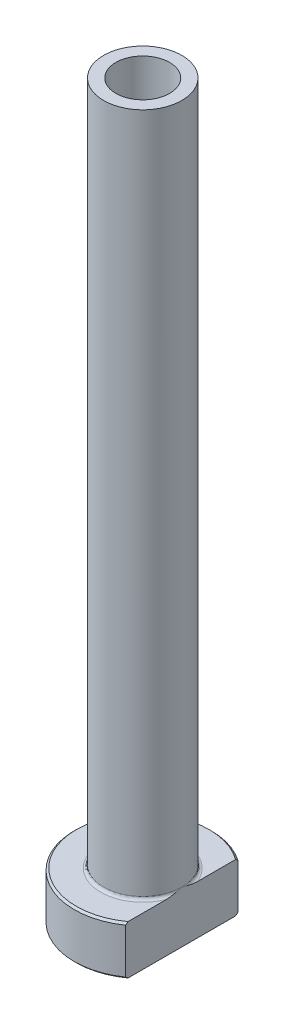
SolidWorks part; units mm, degrees
ref_plane "Front Plane" through (0, 0, 0) normal (0, 0, 1) x (1, 0, 0)
ref_plane "Top Plane" through (0, 0, 0) normal (0, 1, 0) x (1, 0, 0)
ref_plane "Right Plane" through (0, 0, 0) normal (1, 0, 0) x (0, 0, -1)
sketch "Sketch1" plane through (0, 0, 0) normal (0, 0, 1) x (1, 0, 0)
  line L0 (-2.75, 75) -> (-4, 75)
  line L1 (-4, 75) -> (-4, 5)
  line L2 (-4, 5) -> (-7, 5)
  line L3 (-7, 5) -> (-7, 0)
  line L4 (6.05, 0) -> (-6.05, 0) construction
  line L5 (-7, 0) -> (-3, 0)
  line L6 (-2.75, 30) -> (-2.75, 75)
  line L7 (0, 92.1877) -> (0, -15.5353) construction
  line L8 (0, -7.7) -> (0, 7.7) construction
  line L9 (-2.75, 30) -> (-3, 18)
  line L10 (-3, 18) -> (-3, 0)
  dimension "D1" = 0.25
  dimension "ID" = 5.5
  dimension "OD" = 8
  dimension "L" = 75
  dimension "H" = 14
  dimension "T" = 5
  dimension "N" = 45
  dimension "D2" = 12
  dimension "L-N" = 30
revolve "Revolve1" add sketch "Sketch1" angle 360 about L7
fillet "Fillet1" radius 0.3 1 edges at (0, 5, 4)
chamfer "Chamfer1" distance 0.2 angle 45 2 edges at (0, 5, 7) (0, 0, 7)
sketch "Sketch2" plane through (0, 0, 0) normal (0, -1, 0) x (1, 0, 0)
  line L0 (4, 5.7446) -> (4, -5.7446)
  circle A0 centre (0, 0) radius 7 construction
  arc A1 (4, 5.7446) -> (4, -5.7446) centre (0, 0) cw
  circle A2 centre (0, 0) radius 4 construction
extrude "Cut-Extrude1" cut sketch "Sketch2" against normal through all
chamfer "Chamfer2" distance 0.5 angle 45 1 edges at (0, 0, 3)
